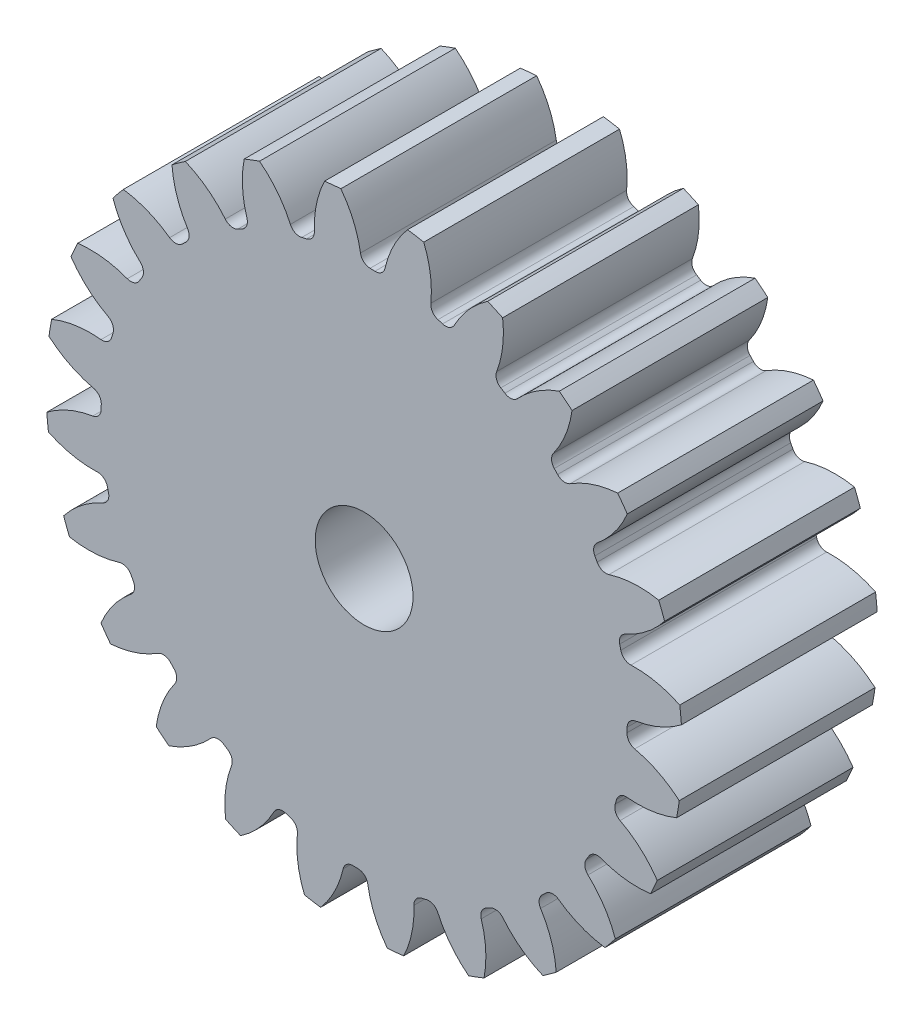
SolidWorks part; units mm, degrees
ref_plane "Front" through (0, 0, 0) normal (0, 0, 1) x (1, 0, 0)
ref_plane "Top" through (0, 0, 0) normal (0, 1, 0) x (1, 0, 0)
ref_plane "Right" through (0, 0, 0) normal (1, 0, 0) x (0, 0, -1)
sketch "Sketch3" plane through (0, 0, 0) normal (0, 0, 1) x (1, 0, 0)
  circle A0 centre (0, 0) radius 165.1
  dimension "od" = 330.2
extrude "gearBody" add sketch "Sketch3" along normal blind 101.6
sketch "Sketch2" plane through (0, 0, 0) normal (0, 0, 1) x (1, 0, 0)
  line L0 (0, 0) -> (132.308, 54.8038) construction
  line L1 (163.9715, -22.9181) -> (0, 0) construction
  line L2 (0, 0) -> (36.3143, 0) construction
  line L3 (152.3154, 5.0774) -> (151.6807, -14.7898) construction
  line L5 (151.998, -4.8562) -> (0, 0) construction
  line L7 (0, 0) -> (143.2092, 0) construction
  arc A0 (143.1904, 2.3197) -> (142.7503, -11.4552) centre (0, 0) ccw construction
  arc A1 (164.6584, 12.0667) -> (163.5524, -22.5527) centre (0, 0) ccw construction
  arc A2 (152.3154, 5.0774) -> (151.6807, -14.7898) centre (0, 0) ccw construction
  arc A3 (136.4093, -5.6191) -> (136.4898, -3.0998) centre (0, 0) ccw
  arc A4 (163.9715, -22.9181) -> (140.4275, -10.872) centre (128.5399, -63.1376) ccw
  arc A5 (163.9715, -22.9181) -> (165.1, 12.4046) centre (0, 0) ccw
  arc A6 (165.1, 12.4046) -> (140.8351, 1.8859) centre (132.308, 54.8038) cw
  arc A7 (136.4898, -3.0998) -> (140.8351, 1.8859) centre (141.6574, -3.2171) cw
  arc A8 (140.4275, -10.872) -> (136.4093, -5.6191) centre (141.5738, -5.8318) cw
  point P6 (165.1, 12.4046)
  point P22 (163.9715, -22.9181)
  dimension "baseDia" = 286.4183
  dimension "od" = 330.2
  dimension "pd" = 304.8
  dimension "rd" = 273.05
  dimension "rFillet" = 5.1689
  dimension "pointX" = 165.1
  dimension "pointY" = 12.4046
  dimension "CTT" = 19.8672
  dimension "flankCenterAngle" = 22.5
extrude "toothCut" cut sketch "Sketch2" along normal through all
pattern_circular "CirPattern1" count 24 over 360 about axis through (0, 0, 0) along (0, 0, 1) of "toothCut"
sketch "hub1Dia" plane through (0, 0, 0) normal (0, 0, -1) x (-1, 0, 0)
  circle A0 centre (0, 0) radius 12.7
  dimension "hub1Dia" = 25.4
sketch "hub2Dia" plane through (0, 0, 101.6) normal (0, 0, 1) x (1, 0, 0)
  circle A0 centre (0, 0) radius 12.7
  dimension "hub2dia" = 25.4
sketch "boreDia" plane through (0, 0, 0) normal (0, 0, 1) x (1, 0, 0)
  circle A0 centre (0, 0) radius 25.4
  dimension "boreDia" = 50.8
extrude "bore" cut sketch "boreDia" against normal mid plane 25400
